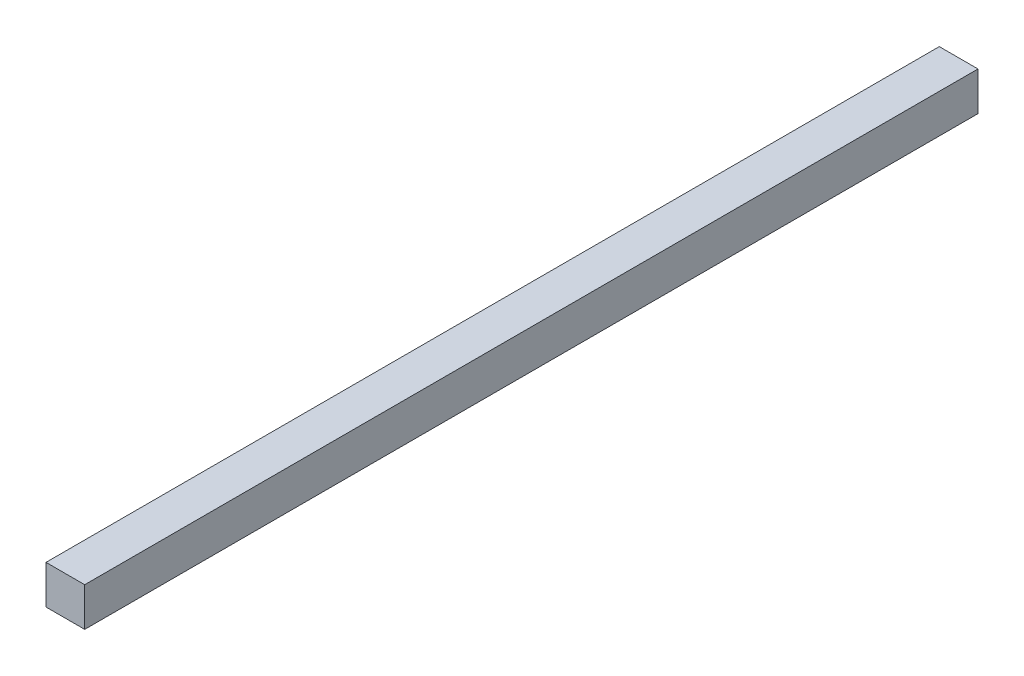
SolidWorks part; units mm, degrees
ref_plane "Plan de face" through (0, 0, 0) normal (0, 0, 1) x (1, 0, 0)
ref_plane "Plan de dessus" through (0, 0, 0) normal (0, 1, 0) x (1, 0, 0)
ref_plane "Plan de droite" through (0, 0, 0) normal (1, 0, 0) x (0, 0, -1)
sketch "Esquisse1" plane through (0, 0, 0) normal (0, 0, 1) x (1, 0, 0)
  line L1 (-6.5, 6.5) -> (6.5, 6.5)
  line L2 (-6.5, 6.5) -> (-6.5, -6.5)
  line L3 (-6.5, -6.5) -> (6.5, -6.5)
  line L4 (6.5, 6.5) -> (6.5, -6.5)
  point P4 (0, 6.5)
  point P5 (-6.5, 0)
  dimension "D1" = 13
extrude "Extrusion1" add sketch "Esquisse1" along normal mid plane 300
